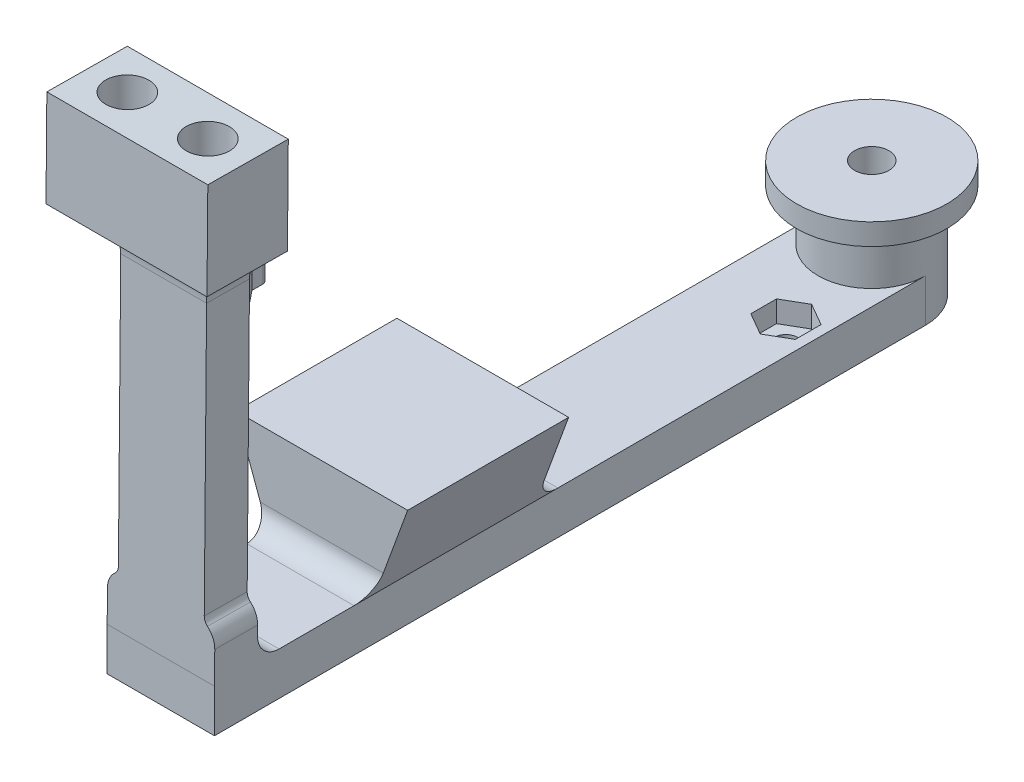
SolidWorks part; units mm, degrees
ref_plane "Ön Düzlem" through (0, 0, 0) normal (0, 0, 1) x (1, 0, 0)
ref_plane "Üst Düzlem" through (0, 0, 0) normal (0, 1, 0) x (1, 0, 0)
ref_plane "Sağ Düzlem" through (0, 0, 0) normal (1, 0, 0) x (0, 0, -1)
sketch "Çizim1" plane through (0, 0, 0) normal (0, 1, 0) x (1, 0, 0)
  circle A0 centre (0, 0) radius 5
  circle A1 centre (0, 0) radius 1.6
  dimension "D1" = 10
  dimension "D2" = 3.2
extrude "Yükseklik-Ekstrüzyon1" add sketch "Çizim1" along normal blind 10.8
sketch "Çizim2" plane through (0, 0, 0) normal (0, 1, 0) x (1, 0, 0)
  line L0 (-5, 0) -> (-5, -66.25)
  line L1 (-5, -66.25) -> (5, -66.25)
  line L2 (5, -66.25) -> (5, 0)
  circle A0 centre (0, 0) radius 5 construction
  arc A1 (-5, 0) -> (5, 0) centre (0, 0) ccw
  dimension "D1" = 66.25
extrude "Yükseklik-Ekstrüzyon2" add sketch "Çizim2" along normal blind 4
sketch "Çizim3" plane through (0, 10.8, 0) normal (0, 1, 0) x (1, 0, 0)
  circle A0 centre (0, 0) radius 7
  circle A1 centre (0, 0) radius 1.6 construction
  circle A2 centre (0, 0) radius 1.6
  dimension "D1" = 14
extrude "Yükseklik-Ekstrüzyon3" add sketch "Çizim3" against normal blind 2
ref_plane "Ebene1" through (0, 12.2, 0) normal (0, 1, 0) x (1, 0, 0)
sketch "Skizze2" plane through (0, 12.2, 0) normal (0, 1, 0) x (1, 0, 0)
  line L0 (-5, 0) -> (-5, -66.25) construction
  line L1 (-8, -36.25) -> (8, -36.25)
  line L2 (-8, -36.25) -> (-8, -51.25)
  line L3 (-8, -51.25) -> (8, -51.25)
  line L4 (8, -36.25) -> (8, -51.25)
  line L5 (5, -66.25) -> (5, 0) construction
  line L6 (-5, -66.25) -> (5, -66.25) construction
  dimension "D1" = 3
  dimension "D2" = 3
  dimension "D3" = 15
  dimension "D4" = 15
sketch "Skizze3" plane through (0, 4, 0) normal (0, 1, 0) x (1, 0, 0)
  line L0 (-5, 0) -> (-5, -66.25) construction
  line L1 (-5, -36.25) -> (5, -36.25)
  line L2 (-5, -36.25) -> (-5, -51.25)
  line L3 (-5, -51.25) -> (5, -51.25)
  line L4 (5, -36.25) -> (5, -51.25)
  line L5 (5, -66.25) -> (5, 0) construction
  line L6 (-8, -51.25) -> (8, -51.25) construction
  line L7 (-8, -36.25) -> (8, -36.25) construction
loft "Ausformung1" add profiles "Skizze3", "Skizze2"
fillet "Verrundung1" radius 2 2 edges
sketch "Skizze5" plane through (-5, 0, 0) normal (-1, 0, 0) x (0, 0, 1)
  line L0 (62.2498, 4) -> (61.8727, 47.2134)
  line L1 (53.25, 4) -> (66.25, 4) construction
  line L2 (61.8727, 47.2134) -> (65.8726, 47.2484)
  line L3 (65.8726, 47.2484) -> (66.25, 4)
  line L4 (62.2498, 4) -> (66.25, 4)
  dimension "D1" = 89.5
  dimension "D2" = 4
  dimension "D3" = 43.25
extrude "Aufsatz-Linear austragen2" add sketch "Skizze5" against normal blind 10
fillet "Verrundung3" radius 2 1 edges at (0, 4, 62.2498)
sketch "Skizze7" plane through (0, 0.5784, 66.2799) normal (0, 0.0087, 1) x (1, 0, 0)
  line L0 (-5, 3.4217) -> (-5, 46.6717) construction
  line L1 (-5, 47.6717) -> (-4, 47.6717)
  line L2 (-5, 47.6717) -> (-5, 7.6717)
  line L3 (-5, 7.6717) -> (-4.9, 7.6717)
  line L4 (-4, 47.6717) -> (-4, 8.5717)
  line L5 (5, 46.6717) -> (-5, 46.6717) construction
  line L6 (0, -5.5) -> (0, 5.5) construction
  line L7 (5, 7.6717) -> (4.9, 7.6717)
  line L8 (4, 47.6717) -> (4, 8.5717)
  line L9 (5, 47.6717) -> (4, 47.6717)
  line L10 (5, 47.6717) -> (5, 7.6717)
  arc A0 (-4.9, 7.6717) -> (-4, 8.5717) centre (-4.9, 8.5717) ccw
  arc A1 (4.9, 7.6717) -> (4, 8.5717) centre (4.9, 8.5717) cw
  dimension "D4" = 0.9
  dimension "D1" = 1
  dimension "D2" = 1
  dimension "D3" = 40
extrude "Schnitt-Linear austragen1" cut sketch "Skizze7" against normal blind 10
fillet "Verrundung4" radius 2 2 edges at (5, 8.2324, 64.213) (-5, 8.2324, 64.213)
ref_plane "Ebene3" through (0, 31.6705, -0.2764) normal (0, 1, -0.0087) x (1, 0, 0)
sketch "Skizze9" plane through (0, 31.6705, -0.2764) normal (0, 1, -0.0087) x (1, 0, 0)
  line L0 (-1.6454, -61.0324) -> (1.6454, -61.0324)
  line L2 (1.6454, -61.0324) -> (0, -58.1824)
  line L3 (0, -5.5) -> (0, 5.5) construction
  line L4 (0, -58.1824) -> (-1.6454, -61.0324)
  line L7 (-3, -59.5324) -> (-3, -61.0324)
  line L9 (-3, -59.5324) -> (3, -59.5324)
  line L10 (3, -59.5324) -> (3, -61.0324)
  line L11 (-3, -61.0324) -> (-4, -62.2824)
  line L12 (-4, -62.2824) -> (4, -62.2824)
  line L13 (4, -62.2824) -> (3, -61.0324)
  line L14 (0, -52.9309) -> (0, -57.7846) construction
  circle A0 centre (0, -60.0824) radius 0.95
  point P3 (0, 0)
  dimension "D1" = 1.9
  dimension "D2" = 6
  dimension "D3" = 2.75
  dimension "D4" = 1.25
extrude "Aufsatz-Linear austragen3" add sketch "Skizze9" along normal blind 10
sketch "Skizze10" plane through (0, 46.6699, -0.4073) normal (0, 1, -0.0087) x (1, 0, 0)
  line L0 (4, -62.2824) -> (-4, -62.2824) construction
  line L1 (-7.5, -62.2824) -> (7.5, -62.2824)
  line L2 (-7.5, -62.2824) -> (-7.5, -69.7824)
  line L3 (-7.5, -69.7824) -> (7.5, -69.7824)
  line L4 (7.5, -62.2824) -> (7.5, -69.7824)
  line L5 (0, -51.3358) -> (0, -67.5089) construction
  line L6 (0, -5.5) -> (0, 5.5) construction
  line L7 (-7.5, -66.0324) -> (7.5, -66.0324) construction
  circle A0 centre (-3.75, -66.0324) radius 2
  circle A1 centre (3.75, -66.0324) radius 2
  dimension "D1" = 4
  dimension "D2" = 4
  dimension "D3" = 7.5
  dimension "D4" = 15
  dimension "D5" = 7.5
extrude "Aufsatz-Linear austragen4" add sketch "Skizze10" against normal blind 7
sketch "Skizze11" plane through (0, 46.6699, -0.4073) normal (0, 1, -0.0087) x (1, 0, 0)
  circle A1 centre (3.75, -66.0324) radius 2
  circle A2 centre (3.75, -66.0324) radius 2
  circle A3 centre (-3.75, -66.0324) radius 2
  circle A4 centre (-3.75, -66.0324) radius 2
  dimension "D1" = 0
  dimension "D2" = 0
extrude "Schnitt-Linear austragen2" cut sketch "Skizze11" against normal blind 7
sketch "Skizze12" plane through (0, 39.6702, -0.3462) normal (0, -1, 0.0087) x (1, 0, 0)
  line L1 (-7.5, 69.7824) -> (7.5, 69.7824)
  line L2 (-7.5, 69.7824) -> (-7.5, 62.2824)
  line L3 (-7.5, 62.2824) -> (7.5, 62.2824)
  line L4 (7.5, 69.7824) -> (7.5, 62.2824)
extrude "Aufsatz-Linear austragen5" add sketch "Skizze12" along normal blind 2
fillet "Verrundung5" radius 4 3 edges at (4, 38.2312, 63.9512) (0, 38.2487, 65.9511) (-4, 38.2312, 63.9512)
sketch "Skizze13" plane through (0, 4, 0) normal (0, 1, 0) x (1, 0, 0)
  line L0 (5, -34.25) -> (5, 0) construction
  line L1 (2, -7.604) -> (4.075, -8.802)
  line L2 (4.075, -8.802) -> (4.075, -11.198)
  line L3 (4.075, -11.198) -> (2, -12.396)
  line L4 (2, -10) -> (2, -15.1318) construction
  line L5 (-0.075, -11.198) -> (2, -12.396)
  line L6 (-0.075, -8.802) -> (-0.075, -11.198)
  line L7 (2, -7.604) -> (-0.075, -8.802)
  line L8 (-5.5, 0) -> (5.5, 0) construction
  circle A0 centre (2, -10) radius 2.075
  dimension "D1" = 4.15
  dimension "D2" = 3
  dimension "D3" = 10
extrude "Schnitt-Linear austragen3" cut sketch "Skizze13" against normal blind 2
sketch "Skizze14" plane through (0, 2, 0) normal (0, 1, 0) x (1, 0, 0)
  circle A0 centre (2, -10) radius 1.075
  dimension "D1" = 2.15
extrude "Schnitt-Linear austragen4" cut sketch "Skizze14" against normal blind 2
fillet "Verrundung6" radius 0.5 2 edges at (3, 37.1898, 59.2101) (-3, 37.1898, 59.2101)
